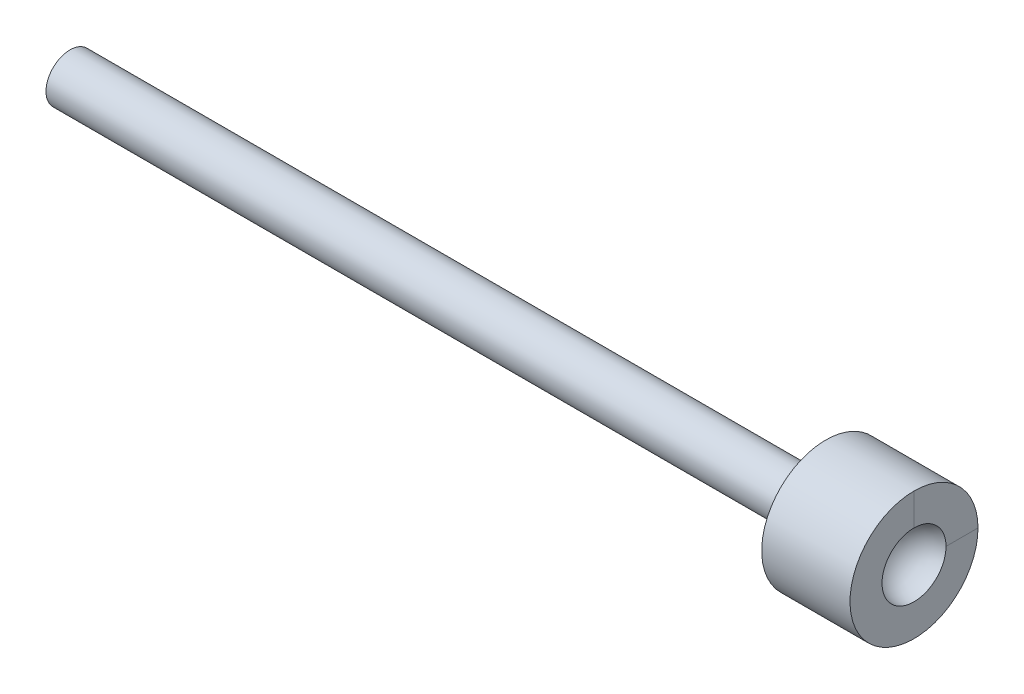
SolidWorks part; units mm, degrees
ref_plane "Front Plane" through (0, 0, 0) normal (0, 0, 1) x (1, 0, 0)
ref_plane "Top Plane" through (0, 0, 0) normal (0, 1, 0) x (1, 0, 0)
ref_plane "Right Plane" through (0, 0, 0) normal (1, 0, 0) x (0, 0, -1)
sketch "Sketch1" plane through (0, 0, 0) normal (0, 0, 1) x (1, 0, 0)
  line L0 (-167.8191, 0) -> (176.5786, 0) construction
  line L1 (0, 32.4255) -> (0, -40.2316) construction
  line L3 (-149.987, 9.525) -> (149.987, 9.525)
  line L4 (-149.987, 9.525) -> (-149.987, 0)
  line L5 (-149.987, 0) -> (149.987, 0)
  line L6 (149.987, 9.525) -> (149.987, 0)
  dimension "D1" = 9.525
  dimension "D2" = 299.974
revolve "Revolve1" add sketch "Sketch1" angle 360 about L0
sketch "Sketch2" plane through (149.987, 0, 0) normal (1, 0, 0) x (0, 0, -1)
  circle A2 centre (0, 0) radius 25.4
  circle A3 centre (0, 0) radius 25.4
  dimension "D1" = 15.875
extrude "Extrude1" add sketch "Sketch2" along normal blind 35.052
sketch "Sketch4" plane through (0, 0, 0) normal (0, 0, 1) x (1, 0, 0)
  line L0 (133.8837, 0) -> (214.8727, 0) construction
  line L1 (185.039, 25.4) -> (185.039, -30.6772) construction
  line L2 (185.039, -25.4) -> (185.039, 25.4) construction
  line L3 (172.339, 0) -> (197.739, 0)
  arc A0 (197.739, 0) -> (172.339, 0) centre (185.039, 0) ccw
  dimension "D1" = 25.4
revolve "Cut-Revolve1" cut sketch "Sketch4" angle 360 about L0
sketch "Sketch6" plane through (185.039, 0, 0) normal (1, 0, 0) x (0, 0, -1)
  line L1 (0, 0) -> (30.2954, 0)
  line L2 (0, 0) -> (0, 32.7669)
  line L3 (0, 32.7669) -> (30.2954, 32.7669)
  line L4 (30.2954, 0) -> (30.2954, 32.7669)
